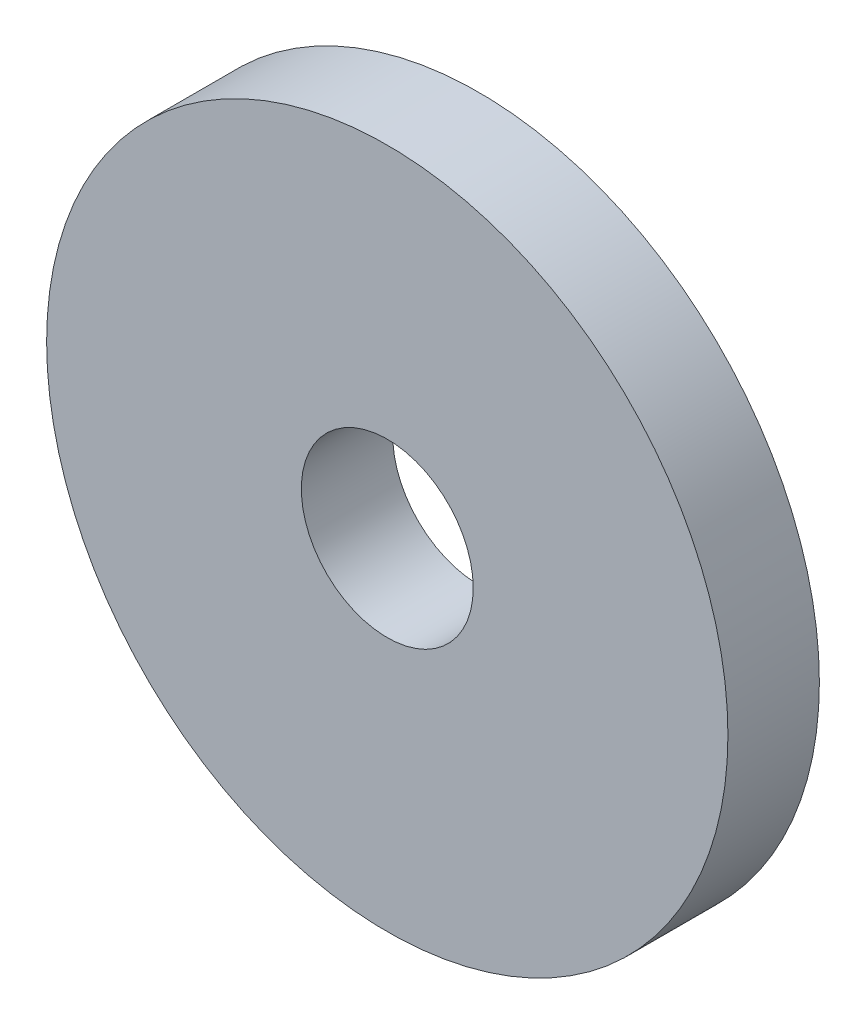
SolidWorks part; units mm, degrees
ref_plane "Front" through (0, 0, 0) normal (0, 0, 1) x (1, 0, 0)
ref_plane "Top" through (0, 0, 0) normal (0, 1, 0) x (1, 0, 0)
ref_plane "Right" through (0, 0, 0) normal (1, 0, 0) x (0, 0, -1)
sketch "Sketch1" plane through (0, 0, 0) normal (0, 0, 1) x (1, 0, 0)
  circle A0 centre (0, 0) radius 2.3876
  circle A1 centre (0, 0) radius 9.4615
  dimension "D1" = 4.7752
  dimension "D2" = 18.923
extrude "Extrude1" add sketch "Sketch1" along normal blind 2.54
